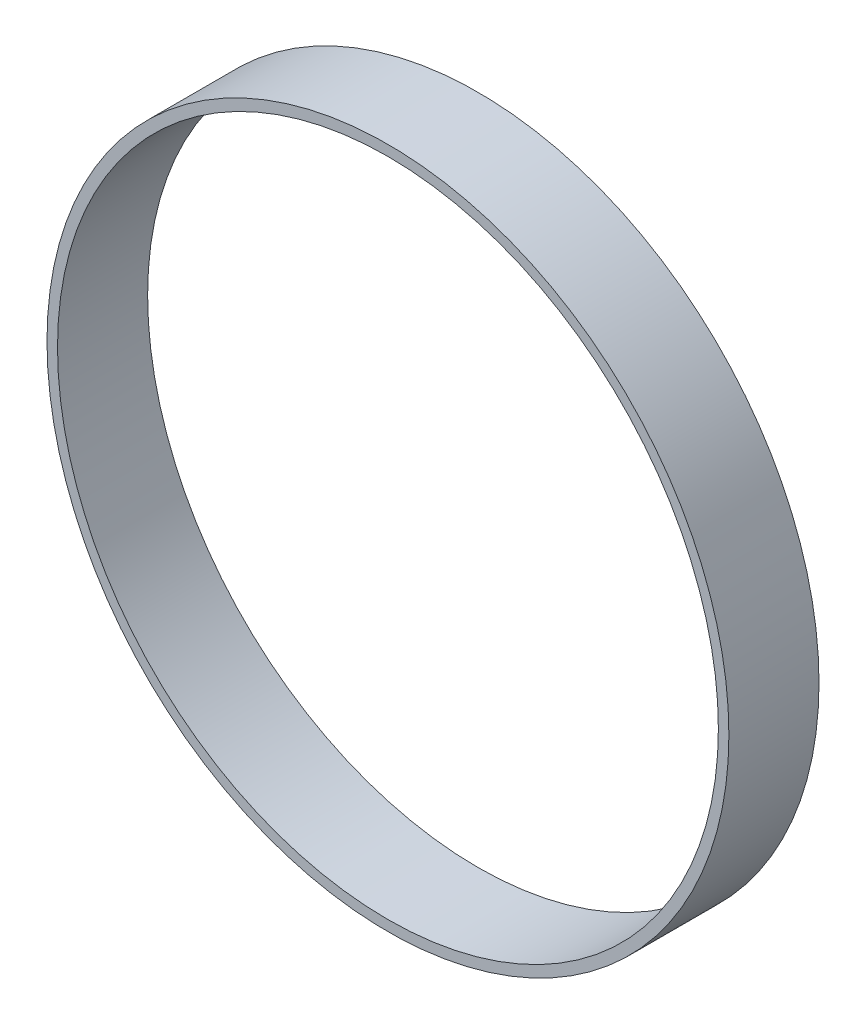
SolidWorks part; units mm, degrees
ref_plane "Plan de face" through (0, 0, 0) normal (0, 0, 1) x (1, 0, 0)
ref_plane "Plan de dessus" through (0, 0, 0) normal (0, 1, 0) x (1, 0, 0)
ref_plane "Plan de droite" through (0, 0, 0) normal (1, 0, 0) x (0, 0, -1)
sketch "Esquisse1" plane through (0, 0, 0) normal (0, 0, 1) x (1, 0, 0)
  circle A0 centre (0, 0) radius 22
  circle A1 centre (0, 0) radius 22.7
extrude "Extrusion1" add sketch "Esquisse1" along normal blind 6
